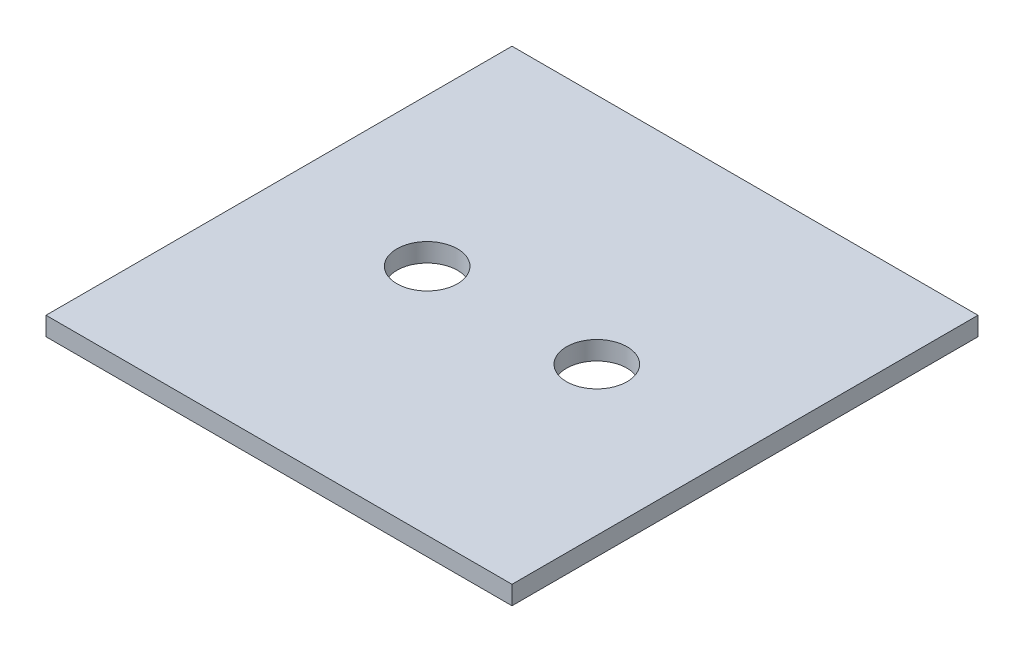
SolidWorks part; units mm, degrees
ref_plane "Front Plane" through (0, 0, 0) normal (0, 0, 1) x (1, 0, 0)
ref_plane "Top Plane" through (0, 0, 0) normal (0, 1, 0) x (1, 0, 0)
ref_plane "Right Plane" through (0, 0, 0) normal (1, 0, 0) x (0, 0, -1)
sketch "Sketch1" plane through (0, 0, 0) normal (0, 1, 0) x (1, 0, 0)
  line L1 (-250, -250) -> (250, -250)
  line L2 (-250, -250) -> (-250, 250)
  line L3 (-250, 250) -> (250, 250)
  line L4 (250, -250) -> (250, 250)
  line L5 (-250, -250) -> (250, 250) construction
  line L6 (-250, 250) -> (250, -250) construction
  point P0 (0, 0)
  dimension "D1" = 500
extrude "Boss-Extrude1" add sketch "Sketch1" along normal blind 20
sketch "Sketch2" plane through (0, 0, 0) normal (0, 1, 0) x (1, 0, 0)
  line L0 (-91, 0) -> (91, 0) construction
  circle A0 centre (-91, 0) radius 32.5
  circle A1 centre (91, 0) radius 32.5
  dimension "D2" = 65
  dimension "D1" = 182
extrude "Cut-Extrude1" cut sketch "Sketch2" along normal through all
